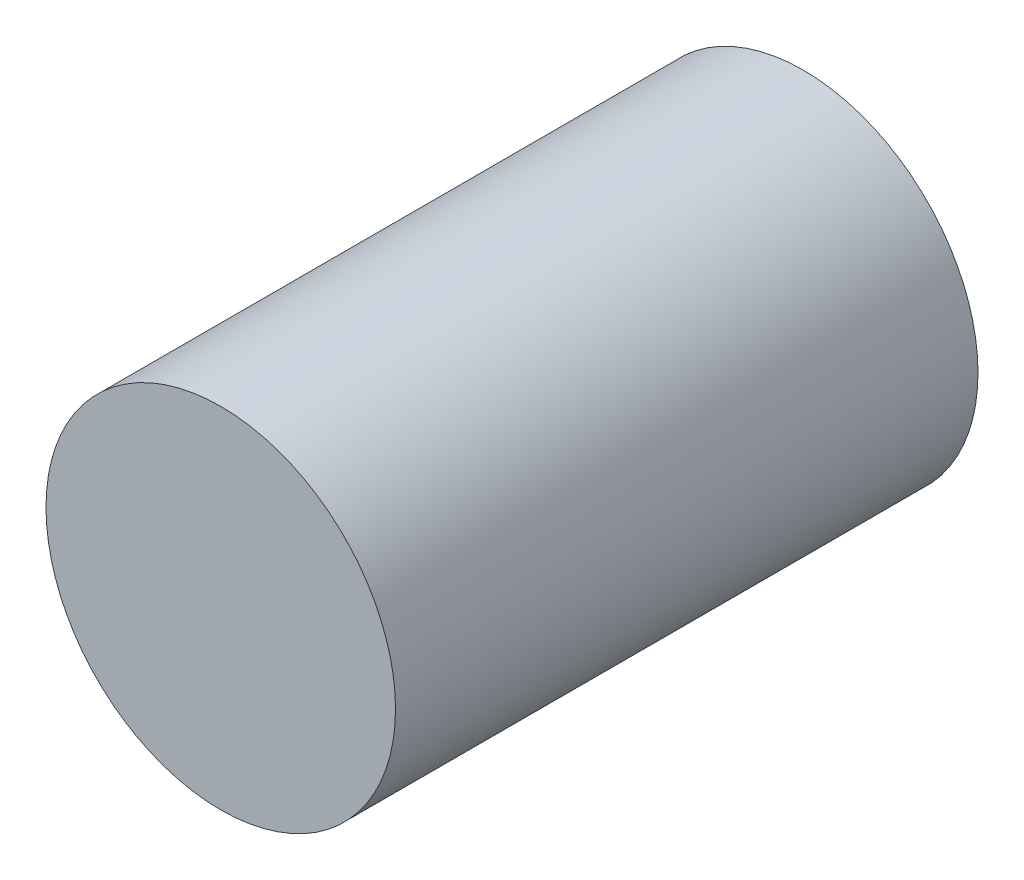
SolidWorks part; units mm, degrees
ref_plane "Plan de face" through (0, 0, 0) normal (0, 0, 1) x (1, 0, 0)
ref_plane "Plan de dessus" through (0, 0, 0) normal (0, 1, 0) x (1, 0, 0)
ref_plane "Plan de droite" through (0, 0, 0) normal (1, 0, 0) x (0, 0, -1)
sketch "Esquisse1" plane through (0, 0, 0) normal (0, 0, 1) x (1, 0, 0)
  circle A0 centre (0, 0) radius 9
extrude "Extrusion1" add sketch "Esquisse1" along normal blind 30
